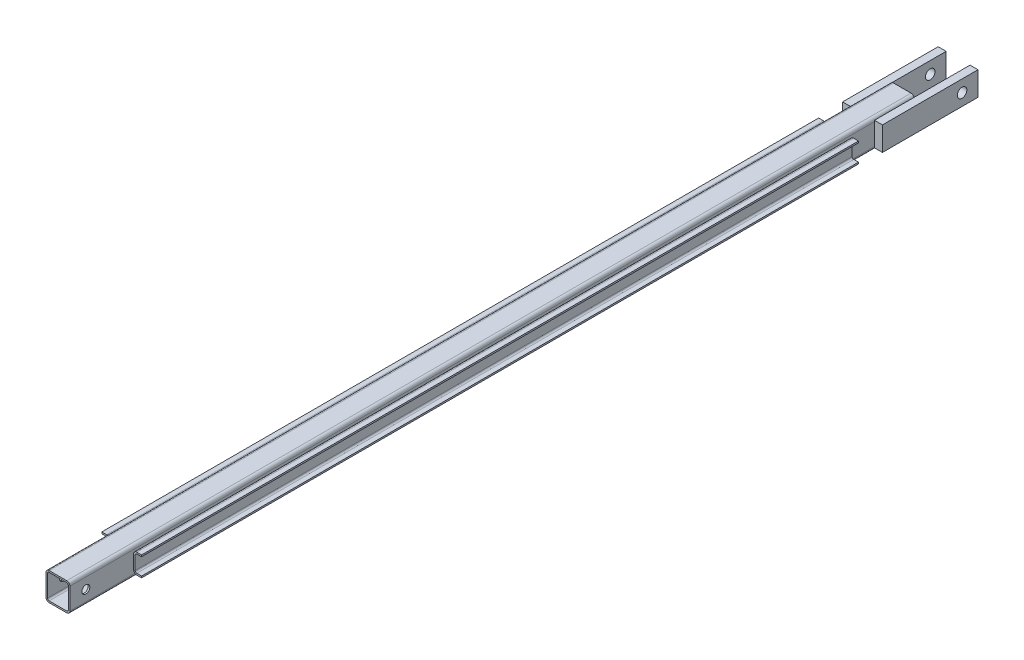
SolidWorks part; units mm, degrees
ref_plane "Face" through (0, 0, 0) normal (0, 0, 1) x (1, 0, 0)
ref_plane "Dessus" through (0, 0, 0) normal (0, 1, 0) x (1, 0, 0)
ref_plane "Droite" through (0, 0, 0) normal (1, 0, 0) x (0, 0, -1)
sketch "Esquisse1" plane through (0, 0, 0) normal (0, 0, 1) x (1, 0, 0)
  line L1 (-11, 17.5) -> (11, 17.5)
  line L2 (-15, 13.5) -> (-15, -13.5)
  line L3 (-11, -17.5) -> (11, -17.5)
  line L4 (15, 13.5) -> (15, -13.5)
  line L5 (-11, 15.5) -> (11, 15.5)
  line L6 (-13, 13.5) -> (-13, -13.5)
  line L7 (-11, -15.5) -> (11, -15.5)
  line L8 (13, 13.5) -> (13, -13.5)
  arc A0 (11, 15.5) -> (13, 13.5) centre (11, 13.5) cw
  arc A1 (11, -15.5) -> (13, -13.5) centre (11, -13.5) ccw
  arc A2 (-13, -13.5) -> (-11, -15.5) centre (-11, -13.5) ccw
  arc A3 (-11, 15.5) -> (-13, 13.5) centre (-11, 13.5) ccw
  arc A4 (11, 17.5) -> (15, 13.5) centre (11, 13.5) cw
  arc A5 (11, -17.5) -> (15, -13.5) centre (11, -13.5) ccw
  arc A6 (-15, -13.5) -> (-11, -17.5) centre (-11, -13.5) ccw
  arc A7 (-11, 17.5) -> (-15, 13.5) centre (-11, 13.5) ccw
  point P18 (15, 17.5)
  point P21 (15, -17.5)
  point P26 (-15, 17.5)
  dimension "D9" = 2
  dimension "D10" = 4
  dimension "D1" = 30
  dimension "D2" = 15
  dimension "D3" = 35
  dimension "D4" = 17.5
  dimension "D5" = 2
  dimension "D6" = 2
  dimension "D7" = 2
  dimension "D8" = 2
extrude "Base-Extrusion" add sketch "Esquisse1" along normal mid plane 1060
sketch "Esquisse2" plane through (0, 0, 0) normal (0, 0, 1) x (1, 0, 0)
  line L0 (15, 8.5) -> (15, -8.5)
  line L1 (15, -13.5) -> (15, 13.5) construction
  line L2 (19, -12.5) -> (25, -12.5)
  line L3 (25, -12.5) -> (25, -10.5)
  line L4 (25, -10.5) -> (19, -10.5)
  line L5 (17, -8.5) -> (17, 8.5)
  line L6 (19, 10.5) -> (25, 10.5)
  line L7 (25, 10.5) -> (25, 12.5)
  line L8 (25, 12.5) -> (19, 12.5)
  arc A0 (15, 8.5) -> (19, 12.5) centre (19, 8.5) cw
  arc A1 (15, -8.5) -> (19, -12.5) centre (19, -8.5) ccw
  arc A2 (17, 8.5) -> (19, 10.5) centre (19, 8.5) cw
  arc A3 (19, -10.5) -> (17, -8.5) centre (19, -8.5) cw
  point P13 (15, 12.5)
  point P16 (15, -12.5)
  dimension "D8" = 4
  dimension "D9" = 2
  dimension "D1" = 2
  dimension "D2" = 2
  dimension "D3" = 2
  dimension "D4" = 25
  dimension "D5" = 12.5
  dimension "D6" = 10
  dimension "D7" = 10
extrude "Boss.-Extru.1" add sketch "Esquisse2" along normal mid plane 900
sketch "Esquisse3" plane through (15, 0, 0) normal (1, 0, 0) x (0, 0, -1)
  line L0 (530, -13.5) -> (530, 13.5) construction
  line L1 (480, -15) -> (600, -15)
  line L2 (480, -15) -> (480, 15)
  line L3 (480, 15) -> (600, 15)
  line L4 (600, -15) -> (600, 15)
  line L5 (530, -13.5) -> (530, 13.5) construction
  dimension "D1" = 30
  dimension "D2" = 15
  dimension "D3" = 120
  dimension "D4" = 50
extrude "Boss.-Extru.2" add sketch "Esquisse3" along normal blind 10
mirror "Symétrie1" about plane through (0, 0, 0) normal (1, 0, 0)
sketch "Esquisse4" plane through (25, 0, 0) normal (1, 0, 0) x (0, 0, -1)
  line L0 (600, -15) -> (600, 15) construction
  line L1 (480, -15) -> (600, -15) construction
  circle A0 centre (580, 0) radius 6
  dimension "D1" = 12
  dimension "D2" = 20
  dimension "D3" = 15
extrude "Enlèv. mat.-Extru.1" cut sketch "Esquisse4" against normal through all
sketch "Esquisse7" plane through (15, 0, 0) normal (1, 0, 0) x (0, 0, -1)
  line L0 (-530, -13.5) -> (-530, 13.5) construction
  circle A0 centre (-510, 0) radius 5
  dimension "D1" = 10
  dimension "D2" = 20
extrude "Enlèv. mat.-Extru.2" cut sketch "Esquisse7" against normal through all
